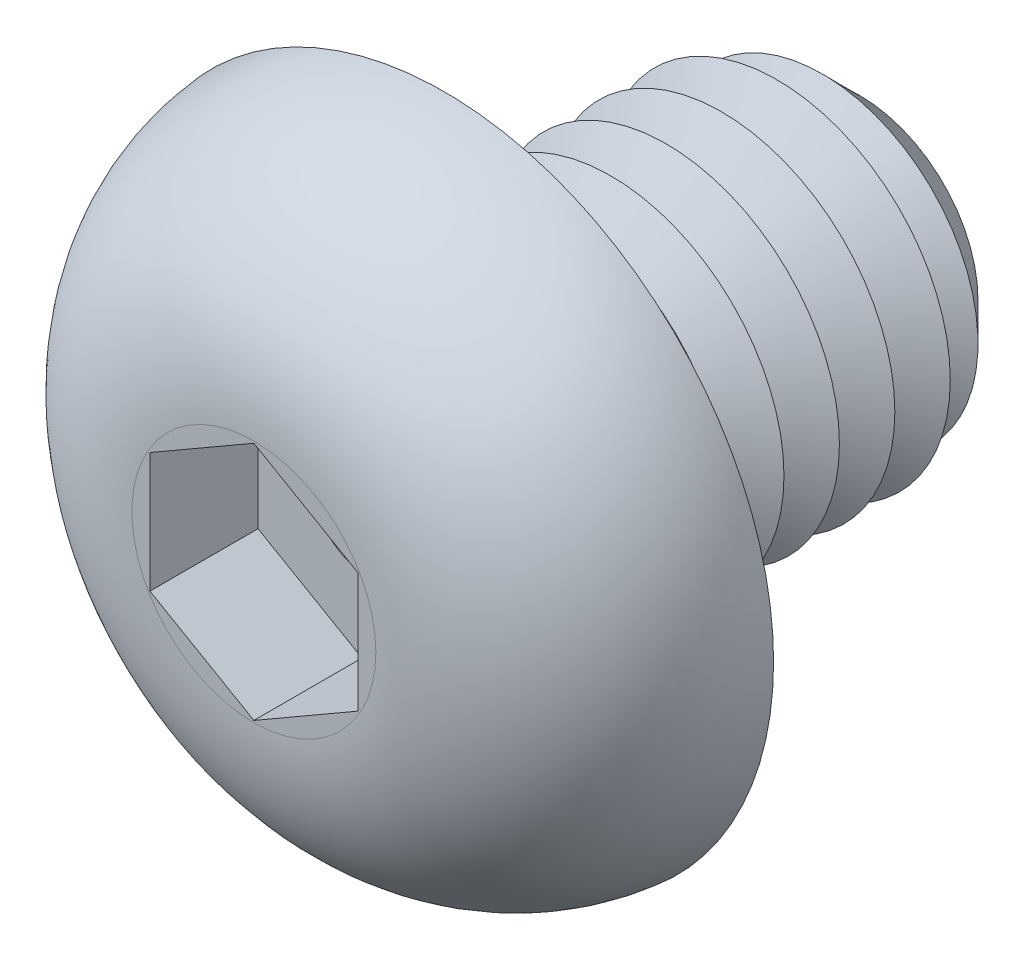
SolidWorks part; units mm, degrees
ref_plane "Front Plane" through (0, 0, 0) normal (0, 0, 1) x (1, 0, 0)
ref_plane "Top Plane" through (0, 0, 0) normal (0, 1, 0) x (1, 0, 0)
ref_plane "Right Plane" through (0, 0, 0) normal (1, 0, 0) x (0, 0, -1)
sketch "Sketch1" plane through (0, 0, 0) normal (1, 0, 0) x (0, 0, -1)
  line L0 (-47.9342, 0) -> (60.3146, 0) construction
sketch "Sketch2" plane through (0, 0, 0) normal (1, 0, 0) x (0, 0, -1)
  line L0 (0, 0) -> (-2.75, 0)
  line L1 (-47.9342, 0) -> (60.3146, 0) construction
  line L2 (-2.75, 0) -> (-2.75, 1.7604)
  line L3 (0, 4.75) -> (0, 0)
  arc A0 (-2.75, 1.7604) -> (0, 4.75) centre (0.25, 1.7604) cw
  dimension "D1" = 3
  dimension "D2" = 2.75
  dimension "D3" = 4.75
revolve "Revolve1" add sketch "Sketch2" angle 360 about L0
sketch "Sketch3" plane through (0, 0, 2.75) normal (0, 0, 1) x (1, 0, 0)
  line L1 (0, 1.7321) -> (-1.5, 0.866)
  line L2 (-1.5, 0.866) -> (-1.5, -0.866)
  line L3 (-1.5, -0.866) -> (0, -1.7321)
  line L4 (0, -1.7321) -> (1.5, -0.866)
  line L5 (1.5, -0.866) -> (1.5, 0.866)
  line L6 (1.5, 0.866) -> (0, 1.7321)
  circle A0 centre (0, 0) radius 1.5 construction
  dimension "D1" = 3
extrude "Cut-Extrude1" cut sketch "Sketch3" against normal blind 1.56
sketch "Sketch4" plane through (0, 0, 0) normal (0, 0, -1) x (-1, 0, 0)
  circle A0 centre (0, 0) radius 2.5
  dimension "D1" = 5
extrude "Boss-Extrude1" add sketch "Sketch4" along normal blind 6
chamfer "Chamfer1" distance 0.8 angle 45 1 edges at (-2.5, 0, -6)
sketch "Sketch5" plane through (0, 0, 0) normal (1, 0, 0) x (0, 0, -1)
  line L0 (0.8, 2.5) -> (1.6, 2.5)
  line L1 (5.2, 2.5) -> (0, 2.5) construction
  line L2 (1.6, 2.5) -> (1.2, 1.8072)
  line L3 (1.2, 1.8072) -> (0.8, 2.5)
  line L4 (0, -4.75) -> (0, 4.75) construction
  line L5 (5.2, 2.5) -> (0, 2.5) construction
  dimension "D1" = 0.8
  dimension "D2" = 0.8
revolve "Cut-Revolve1" cut sketch "Sketch5" angle 360 about L0
pattern_linear "LPattern1" count 6 spacing 0.8 along (0, 0, -1) of "Cut-Revolve1"
fillet "Fillet2" radius 0.4 1 edges at (2.5, 0, 0)
sketch "Sketch6" plane through (0, 0, 1.19) normal (0, 0, 1) x (1, 0, 0)
  circle A0 centre (0, 0) radius 0.65
  dimension "D1" = 1.3
extrude "Cut-Extrude2" cut sketch "Sketch6" against normal up to surface (7.19 mm away)
